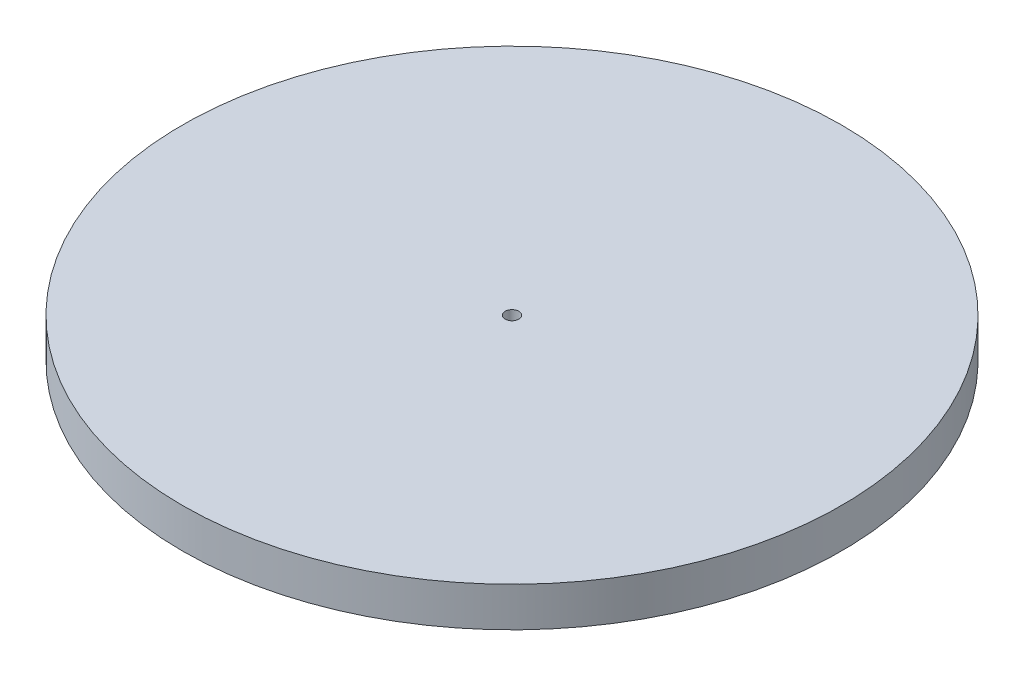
SolidWorks part; units mm, degrees
ref_plane "Front Plane" through (0, 0, 0) normal (0, 0, 1) x (1, 0, 0)
ref_plane "Top Plane" through (0, 0, 0) normal (0, 1, 0) x (1, 0, 0)
ref_plane "Right Plane" through (0, 0, 0) normal (1, 0, 0) x (0, 0, -1)
sketch "Sketch1" plane through (0, 0, 0) normal (0, 1, 0) x (1, 0, 0)
  circle A0 centre (0, 0) radius 152.4
  circle A1 centre (0, 0) radius 3.175
  dimension "D1" = 6.35
  dimension "D2" = 304.8
extrude "Boss-Extrude1" add sketch "Sketch1" along normal blind 18.2562
